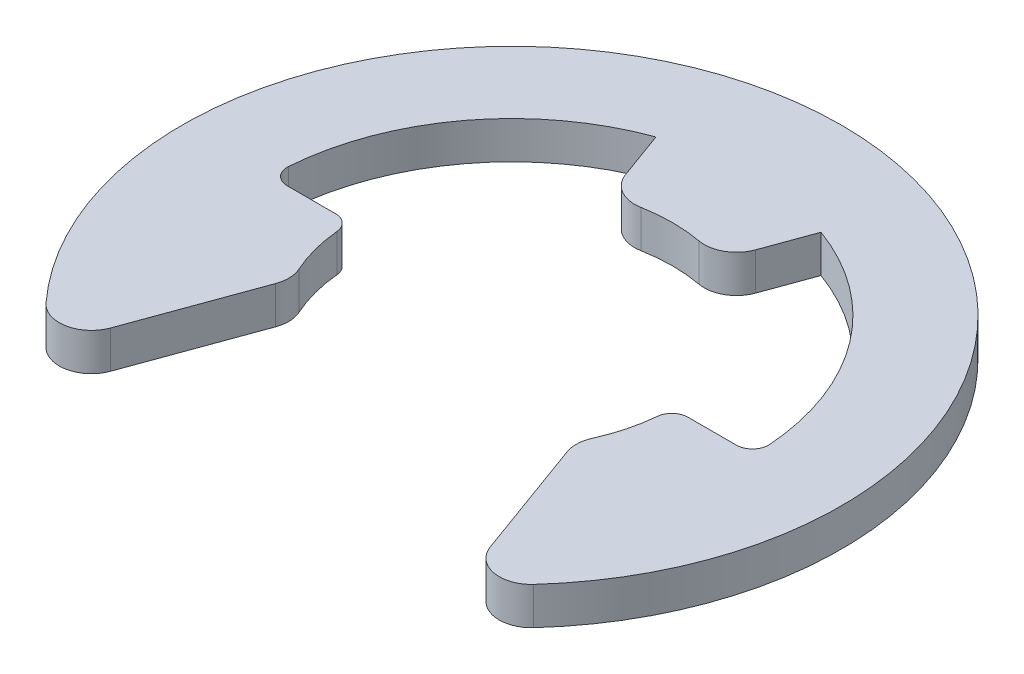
SolidWorks part; units mm, degrees
ref_plane "Front Plane" through (0, 0, 0) normal (0, 0, 1) x (1, 0, 0)
ref_plane "Top Plane" through (0, 0, 0) normal (0, 1, 0) x (1, 0, 0)
ref_plane "Right Plane" through (0, 0, 0) normal (1, 0, 0) x (0, 0, -1)
sketch "Sketch2" plane through (0, 0, 0) normal (0, 1, 0) x (1, 0, 0)
  line L0 (-3.8502, -4.7957) -> (-2.63, -1.4433)
  line L2 (2.63, -1.4433) -> (3.8502, -4.7957)
  line L4 (-3, 0) -> (-4.5, 0)
  line L5 (3, 0) -> (4.5, 0)
  line L6 (-1.5391, 4.2286) -> (-1.0261, 2.8191)
  line L8 (1.0261, 2.8191) -> (1.5391, 4.2286)
  arc A0 (3.8502, -4.7957) -> (-3.8502, -4.7957) centre (0, 0) ccw
  arc A1 (2.63, -1.4433) -> (3, 0) centre (0, 0) ccw
  arc A2 (4.5, 0) -> (1.5391, 4.2286) centre (0, 0) ccw
  arc A3 (-3, 0) -> (-2.63, -1.4433) centre (0, 0) ccw
  arc A4 (1.0261, 2.8191) -> (-1.0261, 2.8191) centre (0, 0) ccw
  arc A5 (-1.5391, 4.2286) -> (-4.5, 0) centre (0, 0) ccw
  point P15 (0, 0)
  point P16 (0, 3)
  dimension "D1" = 12.3
  dimension "D2" = 6
  dimension "D3" = 9
  dimension "D4" = 70
  dimension "D5" = 70
  dimension "D6" = 5.26
  dimension "D7" = 40
extrude "Boss-Extrude1" add sketch "Sketch2" along normal mid plane 0.7
fillet "Fillet1" radius 0.6 6 edges at (2.63, 0, 1.4433) (-2.63, 0, 1.4433) (1.0261, 0, -2.8191) (-1.0261, 0, -2.8191) (3.8502, 0, 4.7957) (-3.8502, 0, 4.7957)
fillet "Fillet2" radius 0.3 4 edges at (4.5, 0, 0) (3, 0, 0) (-4.5, 0, 0) (-3, 0, 0)
